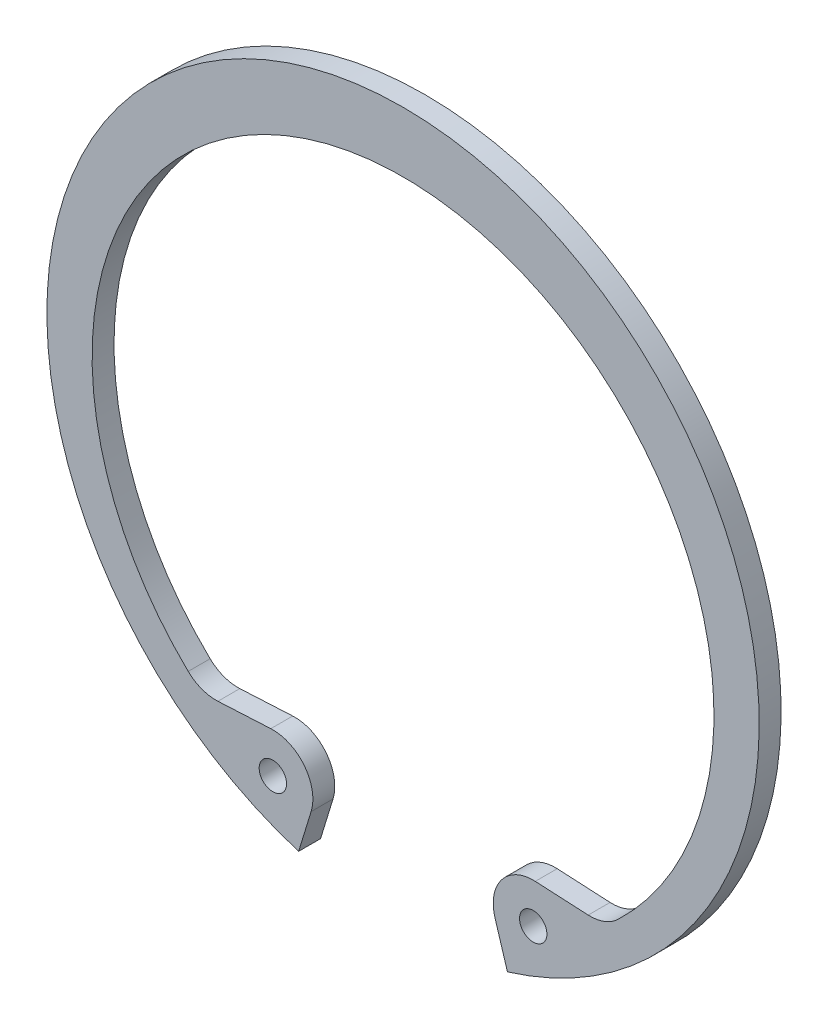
SolidWorks part; units mm, degrees
ref_plane "Face" through (0, 0, 0) normal (0, 0, 1) x (1, 0, 0)
ref_plane "Dessus" through (0, 0, 0) normal (0, 1, 0) x (1, 0, 0)
ref_plane "Droite" through (0, 0, 0) normal (1, 0, 0) x (0, 0, -1)
sketch "Esquisse1" plane through (0, 0, 0) normal (0, 0, 1) x (1, 0, 0)
  line L0 (0, 27) -> (0, 32.5) construction
  line L1 (8.3892, -27.3609) -> (9.5271, -31.0722)
  line L2 (10.376, -22.9647) -> (13.3817, -29.6172) construction
  line L3 (16.8946, -22.8949) -> (12.0669, -22.6458)
  line L4 (-16.8946, -22.8949) -> (-12.0669, -22.6458)
  line L5 (-8.3892, -27.3609) -> (-9.5271, -31.0722)
  line L6 (9.9932, -27.4561) -> (11.3209, -31.1038) construction
  line L7 (-9.9932, -27.4561) -> (-11.3209, -31.1038) construction
  arc A0 (9.5271, -31.0722) -> (-9.5271, -31.0722) centre (0, 0) ccw
  arc A1 (19.6045, -21.8885) -> (-19.6045, -21.8885) centre (0, -1.375) ccw
  arc A2 (12.0669, -22.6458) -> (8.3892, -27.3609) centre (11.8788, -26.291) ccw
  arc A3 (16.8946, -22.8949) -> (19.6045, -21.8885) centre (17.0827, -19.2498) ccw
  circle A4 centre (11.8788, -26.291) radius 1.25
  arc A5 (-16.8946, -22.8949) -> (-19.6045, -21.8885) centre (-17.0827, -19.2498) cw
  circle A6 centre (-11.8788, -26.291) radius 1.25
  arc A7 (-12.0669, -22.6458) -> (-8.3892, -27.3609) centre (-11.8788, -26.291) cw
  arc A8 (11.3209, -31.1038) -> (-11.3209, -31.1038) centre (0, 0) ccw construction
  circle A9 centre (0, 0) radius 31 construction
  dimension "dgorge" = 65
  dimension "D3" = 1.375
  dimension "dtrou" = 2.5
  dimension "dext" = 66.2
  dimension "dn" = 62
  dimension "b" = 5.5
  dimension "a" = 7.3
  dimension "D5" = 70
  dimension "D7" = 34.092
  dimension "D9" = 40
extrude "Base-Extrusion" add sketch "Esquisse1" along normal blind 2
equation "\"D3@Esquisse1\" = \"b@Esquisse1\"/4"
equation "\"D7@Esquisse1\" = 360-(360-\"D9@Esquisse1\")*\"dext@Esquisse1\"/\"dgorge@Esquisse1\""
